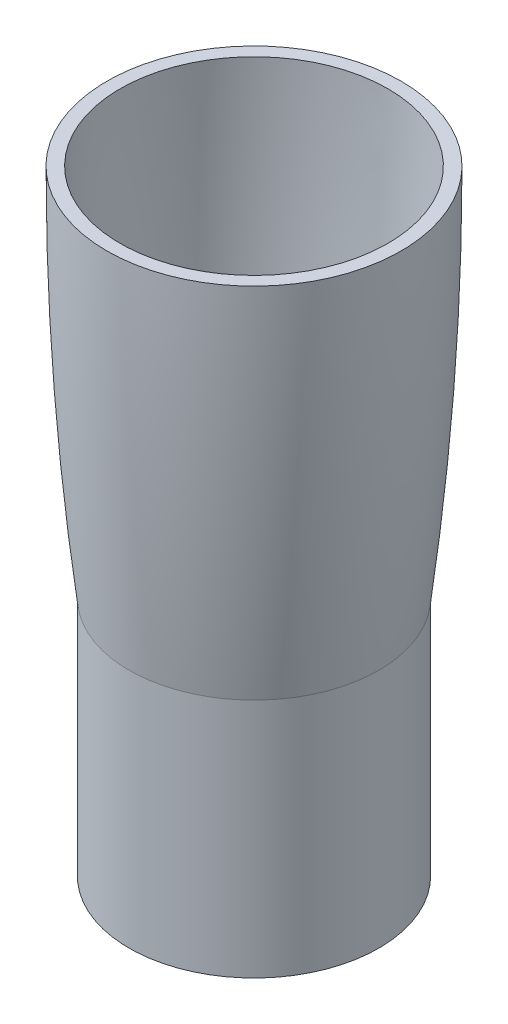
SolidWorks part; units mm, degrees
ref_plane "Front Plane" through (0, 0, 0) normal (0, 0, 1) x (1, 0, 0)
ref_plane "Top Plane" through (0, 0, 0) normal (0, 1, 0) x (1, 0, 0)
ref_plane "Right Plane" through (0, 0, 0) normal (1, 0, 0) x (0, 0, -1)
sketch "Sketch1" plane through (0, 0, 0) normal (0, 0, 1) x (1, 0, 0)
  line L0 (33.2757, 152.7564) -> (36.5416, 152.7564)
  line L1 (27.7632, 0) -> (31.0292, 0)
  line L2 (31.0292, 59.7853) -> (31.0292, 0)
  line L3 (0, 0) -> (0, 194.5316) construction
  line L6 (27.7632, 59.9791) -> (27.7632, 0)
  arc A2 (27.7632, 59.9791) -> (33.2757, 152.7564) centre (-750.2251, 152.7564) ccw
  arc A6 (31.0292, 59.7853) -> (36.5416, 152.7564) centre (-750.2251, 152.7564) ccw
  dimension "D4" = 783.5008
  dimension "D1" = 55.5264
  dimension "D2" = 3.266
  dimension "D5" = 152.7564
  dimension "D6" = 59.7853
  dimension "D7" = 750.2251
  dimension "D9" = 152.7564
revolve "Revolve1" add sketch "Sketch1" angle 360 about L3
